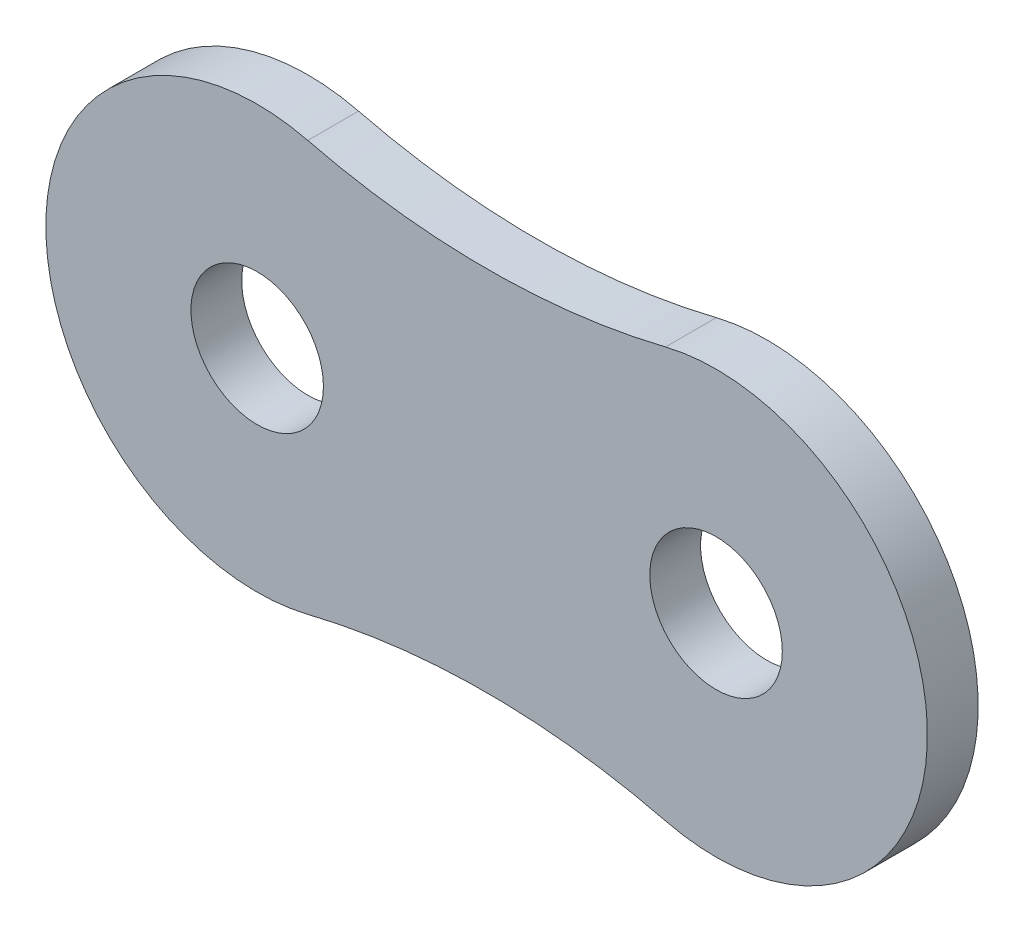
SolidWorks part; units mm, degrees
ref_plane "前视基准面" through (0, 0, 0) normal (0, 0, 1) x (1, 0, 0)
ref_plane "上视基准面" through (0, 0, 0) normal (0, 1, 0) x (1, 0, 0)
ref_plane "右视基准面" through (0, 0, 0) normal (1, 0, 0) x (0, 0, -1)
sketch "草图1" plane through (0, 0, 0) normal (0, 0, 1) x (1, 0, 0)
  line L0 (-4, 0) -> (4, 0) construction
  line L1 (0, 3.1995) -> (0, -3.1995) construction
  line L2 (4, 0) -> (7, 0) construction
  line L3 (7, 0) -> (11.77, 0) construction
  circle A4 centre (-4, 0) radius 3.685
  circle A5 centre (4, 0) radius 3.685
  circle A6 centre (0, 16.2351) radius 13.0356
  circle A7 centre (0, -16.2351) radius 13.0356
  circle A8 centre (-4, 0) radius 1.155
  circle A9 centre (4, 0) radius 1.155
  dimension "h1" = 7.37
  dimension "d2" = 2.31
  dimension "p" = 8
  dimension "h3" = 6.399
  dimension "b1" = 3
  dimension "b2" = 4.77
sketch "草图2" plane through (0, 0, 0) normal (0, 0, 1) x (1, 0, 0)
  circle A0 centre (-4, 0) radius 3.685 construction
  arc A1 (-3.1185, 3.578) -> (-3.1185, -3.578) centre (-4, 0) ccw
  circle A2 centre (4, 0) radius 3.685 construction
  arc A3 (3.1185, -3.578) -> (3.1185, 3.578) centre (4, 0) ccw
  circle A4 centre (0, 16.2351) radius 13.0356 construction
  arc A5 (-3.1185, 3.578) -> (3.1185, 3.578) centre (0, 16.2351) ccw
  circle A6 centre (0, -16.2351) radius 13.0356 construction
  arc A7 (3.1185, -3.578) -> (-3.1185, -3.578) centre (0, -16.2351) ccw
extrude "拉伸1" add sketch "草图2" along normal blind 0.885
sketch "草图3" plane through (0, 0, 0.885) normal (0, 0, 1) x (1, 0, 0)
  circle A0 centre (-4, 0) radius 1.155 construction
  circle A1 centre (-4, 0) radius 1.155
  circle A2 centre (4, 0) radius 1.155 construction
  circle A3 centre (4, 0) radius 1.155
extrude "切除-拉伸1" cut sketch "草图3" against normal through all
equation "\"D@拉伸1\" = (  \"b2@草图1\" - \"b1@草图1\" )  / 2"
